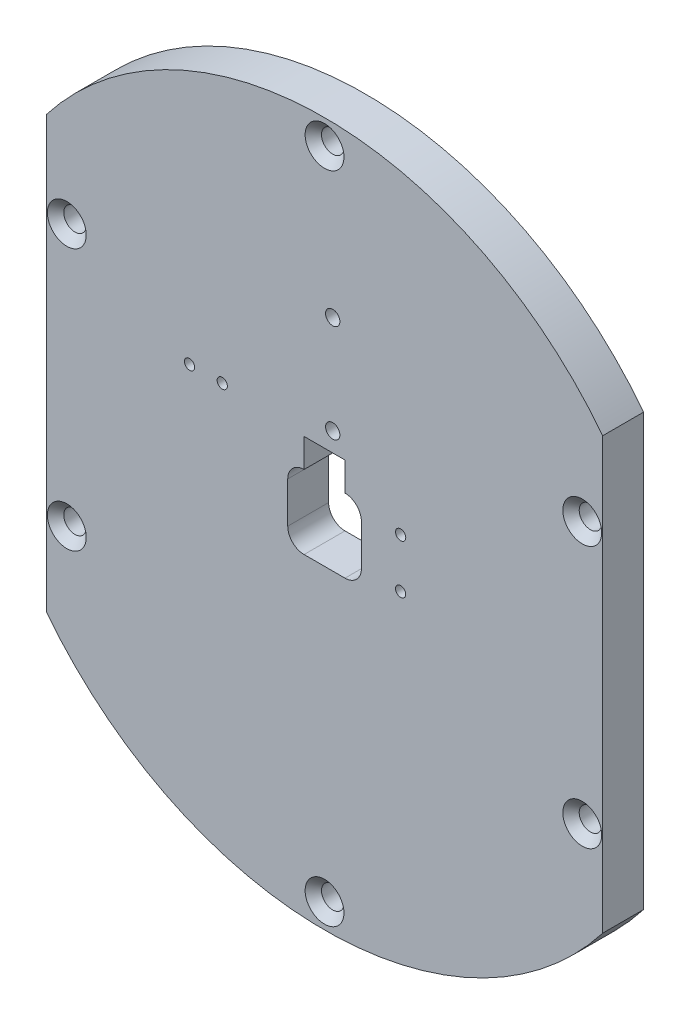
SolidWorks part; units mm, degrees
ref_plane "Plan de face" through (0, 0, 0) normal (0, 0, 1) x (1, 0, 0)
ref_plane "Plan de dessus" through (0, 0, 0) normal (0, 1, 0) x (1, 0, 0)
ref_plane "Plan de droite" through (0, 0, 0) normal (1, 0, 0) x (0, 0, -1)
sketch "Esquisse1" plane through (0, 0, 0) normal (0, 0, 1) x (1, 0, 0)
  line L0 (0, 83.9611) -> (0, -82.0979) construction
  line L1 (-100.2652, 0) -> (105.62, 0) construction
  line L2 (-17.5, -65.3109) -> (0, -35) construction
  line L3 (0, 35) -> (-17.5, 65.3109) construction
  line L4 (-47.8109, 47.8109) -> (-30.3109, 17.5) construction
  line L5 (-30.3109, -17.5) -> (-47.8109, -47.8109) construction
  line L6 (30.3109, 17.5) -> (30.3109, -17.5) construction
  line L7 (17.5, 65.3109) -> (47.8109, 47.8109) construction
  line L8 (47.8109, -47.8109) -> (17.5, -65.3109) construction
  line L9 (-47.8109, -47.8109) -> (-17.5, -65.3109) construction
  circle A0 centre (0, -35) radius 17.5 construction
  circle A1 centre (-17.5, -65.3109) radius 17.5 construction
  circle A2 centre (17.5, -65.3109) radius 17.5 construction
  circle A3 centre (47.8109, -47.8109) radius 17.5 construction
  circle A4 centre (47.8109, 47.8109) radius 17.5 construction
  circle A5 centre (17.5, 65.3109) radius 17.5 construction
  circle A6 centre (30.3109, -17.5) radius 17.5 construction
  circle A7 centre (30.3109, 17.5) radius 17.5 construction
  circle A8 centre (-30.3109, -17.5) radius 17.5 construction
  circle A9 centre (0, 35) radius 17.5 construction
  circle A10 centre (-47.8109, 47.8109) radius 17.5 construction
  circle A11 centre (-30.3109, 17.5) radius 17.5 construction
  circle A12 centre (-17.5, 65.3109) radius 17.5 construction
  circle A13 centre (-47.8109, -47.8109) radius 17.5 construction
  dimension "D2" = 35
  dimension "D1" = 35
sketch "Esquisse3" plane through (0, 0, 0) normal (0, 0, 1) x (1, 0, 0)
  line L0 (-68, 52.6498) -> (-68, -52.6498)
  line L1 (68, 52.6498) -> (68, -52.6498)
  line L2 (0, 83.9611) -> (0, -82.0979) construction
  line L3 (5, 9) -> (9, 9)
  line L4 (-9, 9) -> (-5, 9)
  line L5 (-9, 9) -> (-9, -9)
  line L6 (-9, -9) -> (9, -9)
  line L7 (9, 9) -> (9, -9)
  line L9 (-5, 9) -> (-5, 16)
  line L10 (-5, 16) -> (5, 16)
  line L11 (5, 9) -> (5, 16)
  arc A0 (68, 52.6498) -> (-68, 52.6498) centre (0, 0) ccw
  arc A1 (-68, -52.6498) -> (68, -52.6498) centre (0, 0) ccw
  dimension "D1" = 172
  dimension "D4" = 18
  dimension "D2" = 68
  dimension "D3" = 68
  dimension "D5" = 9
  dimension "D6" = 9
  dimension "D7" = 18
  dimension "D9" = 10
  dimension "D10" = 5
  dimension "D11" = 7
extrude "Boss.-Extru.1" add sketch "Esquisse3" along normal blind 10
sketch "Esquisse4" plane through (0, 0, 0) normal (0, 0, -1) x (-1, 0, 0)
  circle A0 centre (-23.9054, 41.4054) radius 7.2487
  circle A1 centre (23.9054, 41.4054) radius 7.2487
  circle A2 centre (23.9054, -41.4054) radius 7.2487
  circle A3 centre (-23.9054, -41.4054) radius 7.2487
extrude "Boss.-Extru.2" add sketch "Esquisse4" along normal blind 10
sketch "Esquisse5" plane through (0, 0, 10) normal (0, 0, 1) x (1, 0, 0)
  circle A0 centre (2, 44.6709) radius 1.75
  circle A1 centre (2, 20.6709) radius 1.75
  dimension "D4" = 3.5
  dimension "D1" = 20.6709
  dimension "D2" = 24
  dimension "D3" = 2
extrude "Enlèv. mat.-Extru.1" cut sketch "Esquisse5" against normal blind 10
sketch "Esquisse6" plane through (0, 0, 10) normal (0, 0, 1) x (1, 0, 0)
  circle A0 centre (18.6, 6.9732) radius 1.25
  circle A1 centre (18.6, -5.0268) radius 1.25
  dimension "D4" = 2.5
  dimension "D1" = 12
  dimension "D2" = 6.9732
  dimension "D3" = 18.6
extrude "Enlèv. mat.-Extru.2" cut sketch "Esquisse6" against normal blind 10
sketch "Esquisse7" plane through (0, 0, 10) normal (0, 0, 1) x (1, 0, 0)
  line L0 (0, 100.9025) -> (0, -100.4612) construction
  line L1 (-86.2054, 0) -> (94.5563, 0) construction
  circle A0 centre (0, 80) radius 2.75
  circle A1 centre (-63, 32) radius 2.75
  circle A2 centre (63, 32) radius 2.75
  dimension "D1" = 5.5
  dimension "D3" = 63
  dimension "D4" = 5.5
  dimension "D2" = 80
  dimension "D5" = 32
  dimension "D6" = 63
extrude "Enlèv. mat.-Extru.3" cut sketch "Esquisse7" against normal blind 10
chamfer "Chanfrein1" distance 2 angle 45 3 edges at (65.75, 32, 10) (2.75, 80, 10) (-60.25, 32, 10)
mirror "Symétrie1" about plane through (0, 0, 0) normal (0, 1, 0) of "Chanfrein1", "Enlèv. mat.-Extru.3"
fillet "Congé1" radius 4 4 edges at (9, -9, 5) (9, 9, 5) (-9, 9, 5) (-9, -9, 5)
hole_wizard "Trou taraudé M31" positions "Esquisse9" profile "Esquisse8" tap size "M3" standard "ISO"
sketch "Esquisse9" plane through (0, 0, 10) normal (0, 0, 1) x (1, 0, 0)
  point P1 (-33, 17.259)
  point P4 (-25, 17.259)
sketch "Esquisse8" plane through (-33, 17.259, 10) normal (1, 0, 0) x (0, -1, 0)
  line L0 (0, 0) -> (0, 20)
  line L1 (0, 20) -> (1.25, 20)
  line L2 (1.25, 20) -> (1.25, 0)
  line L5 (1.25, 0) -> (0, 0)
  line L11 (0, -6.35) -> (0, 107.95) construction
  dimension "Diamètre du trou pour taraudage jusqu'au prochain" = 2.5
  dimension "Profondeur du trou pour taraudage jusqu'au prochain" = 20
